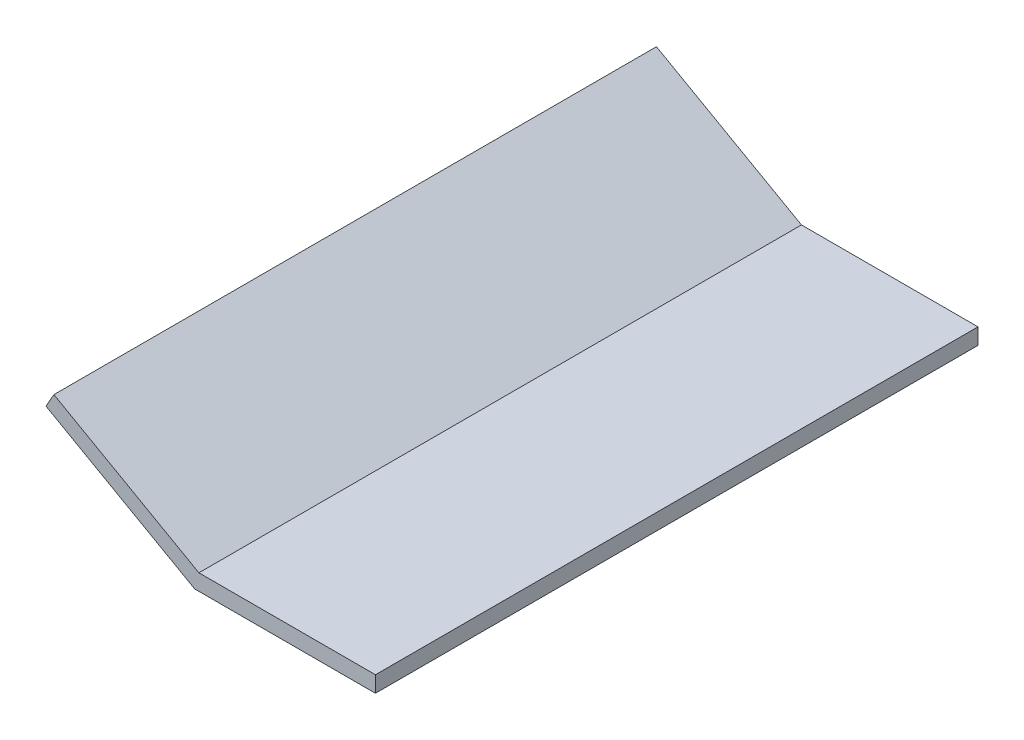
SolidWorks part; units mm, degrees
ref_plane "Front" through (0, 0, 0) normal (0, 0, 1) x (1, 0, 0)
ref_plane "Top" through (0, 0, 0) normal (0, 1, 0) x (1, 0, 0)
ref_plane "Right" through (0, 0, 0) normal (1, 0, 0) x (0, 0, -1)
sketch "Sketch1" plane through (0, 0, 0) normal (0, 0, 1) x (1, 0, 0)
  line L0 (0, 0) -> (9, 0)
  line L1 (9, 0) -> (9, 0.8)
  line L2 (9, 0.8) -> (0.2102, 0.8)
  line L3 (0.2102, 0.8) -> (-7.0092, 4.8745)
  line L4 (-7.0092, 4.8745) -> (-7.4024, 4.1779)
  line L5 (-7.4024, 4.1779) -> (0, 0)
  point P6 (-3.4132, 11.9028)
  point P8 (2.9874, 4.1779)
  point P9 (2.5607, 6.3555)
  dimension "D1" = 150.56
  dimension "D2" = 9
  dimension "D3" = 8.5
  dimension "D4" = 0.8
  dimension "D5" = 0.8
extrude "Boss-Extrude1" add sketch "Sketch1" along normal blind 30
